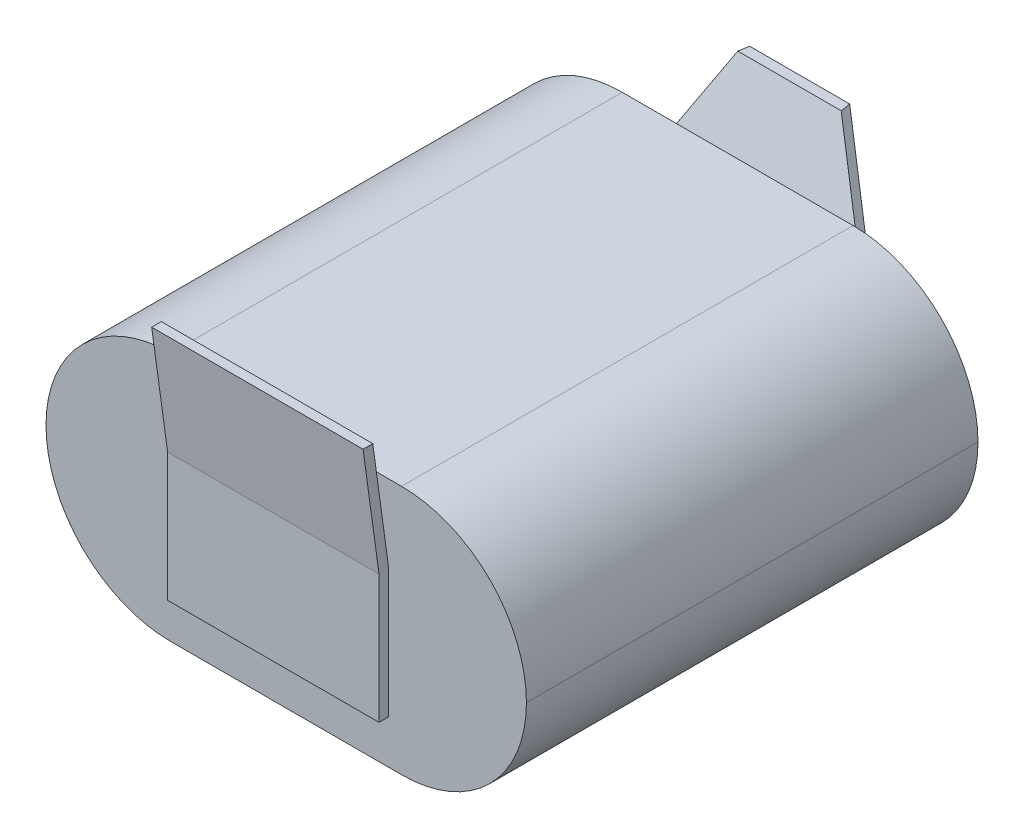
SolidWorks part; units mm, degrees
ref_plane "Plan de face" through (0, 0, 0) normal (0, 0, 1) x (1, 0, 0)
ref_plane "Plan de dessus" through (0, 0, 0) normal (0, 1, 0) x (1, 0, 0)
ref_plane "Plan de droite" through (0, 0, 0) normal (1, 0, 0) x (0, 0, -1)
sketch "Esquisse1" plane through (0, 0, 0) normal (0, 0, 1) x (1, 0, 0)
  line L7 (-8.8391, -7.6) -> (3.1709, -7.6)
  line L8 (9.6709, -14.11) -> (9.6709, -14.1)
  line L9 (-8.8291, -20.6) -> (3.1809, -20.6)
  line L10 (-15.3291, -14.1) -> (-15.3291, -14.09)
  arc A4 (9.6709, -14.1) -> (3.1709, -7.6) centre (3.1709, -14.1) ccw
  arc A5 (3.1809, -20.6) -> (9.6709, -14.11) centre (3.1809, -14.11) ccw
  arc A6 (-15.3291, -14.1) -> (-8.8291, -20.6) centre (-8.8291, -14.1) ccw
  arc A7 (-8.8391, -7.6) -> (-15.3291, -14.09) centre (-8.8391, -14.09) ccw
extrude "Extrusion1" add sketch "Esquisse1" against normal blind 23.5
ref_plane "Plan4" through (-3, 0, 0) normal (1, 0, 0) x (0, 0, -1)
sketch "Esquisse2" plane through (-3, 0, 0) normal (1, 0, 0) x (0, 0, -1)
  line L0 (0, -18.3247) -> (0, -11.6079)
  line L1 (0, -14.11) -> (0, -20.6) construction
  line L2 (0, -7.6) -> (0, -14.1) construction
  line L3 (0, -11.6079) -> (-0.8242, -5.6)
  line L4 (-17, -5.6) -> (41, -5.6) construction
  line L5 (-0.5, -18.3247) -> (-0.5, -11.642)
  line L6 (-0.5, -11.642) -> (-1.3289, -5.6)
  line L7 (-0.5, -18.3247) -> (0, -18.3247)
  line L8 (-0.8242, -5.6) -> (-1.3289, -5.6)
  line L9 (-0.5, -11.642) -> (-1.3196, -5.668) construction
  dimension "D1" = 0.5
extrude "Extrusion2" add sketch "Esquisse2" along normal mid plane 11
sketch "Esquisse3" plane through (-3, 0, 0) normal (1, 0, 0) x (0, 0, -1)
  line L0 (23.5, -18.3247) -> (24, -18.3247)
  line L1 (23.5, -20.6) -> (23.5, -14.11) construction
  line L2 (24, -18.3247) -> (24, -14.11)
  line L3 (24, -14.11) -> (26.891, -5.6)
  line L4 (-17, -5.6) -> (41, -5.6) construction
  line L5 (23.5, -18.3247) -> (23.5, -14.0274)
  line L6 (23.5, -14.0274) -> (26.3629, -5.6)
  line L7 (26.891, -5.6) -> (26.3629, -5.6)
  line L8 (23.5, -14.0274) -> (26.4176, -5.4392) construction
  dimension "D1" = 0.5
extrude "Extrusion3" add sketch "Esquisse3" along normal mid plane 11
sketch "Esquisse4" plane through (0, -8.7695, -25.8142) normal (0, -0.3217, -0.9469) x (-1, 0, 0)
  line L0 (3, 3.3475) -> (3, -6.9889) construction
  line L1 (-2.5, 3.3475) -> (8.5, 3.3475) construction
  line L2 (0.6454, 3.8348) -> (-2.5, -2.3215)
  line L3 (-2.5, -5.6402) -> (-2.5, 3.3475) construction
  line L4 (-2.5, -2.3215) -> (-3.2576, -2.3215)
  line L5 (-3.2576, -2.3215) -> (-3.2576, 4.72)
  line L6 (8.5, -2.3215) -> (9.2576, -2.3215)
  line L7 (5.3546, 3.8348) -> (8.5, -2.3215)
  line L8 (9.2576, -2.3215) -> (9.2576, 4.72)
  line L9 (0.6454, 3.8348) -> (5.3546, 3.8348)
  line L10 (-3.2576, 4.72) -> (9.2576, 4.72)
extrude "Enlèv. mat.-Extru.1" cut sketch "Esquisse4" against normal blind 0.5
